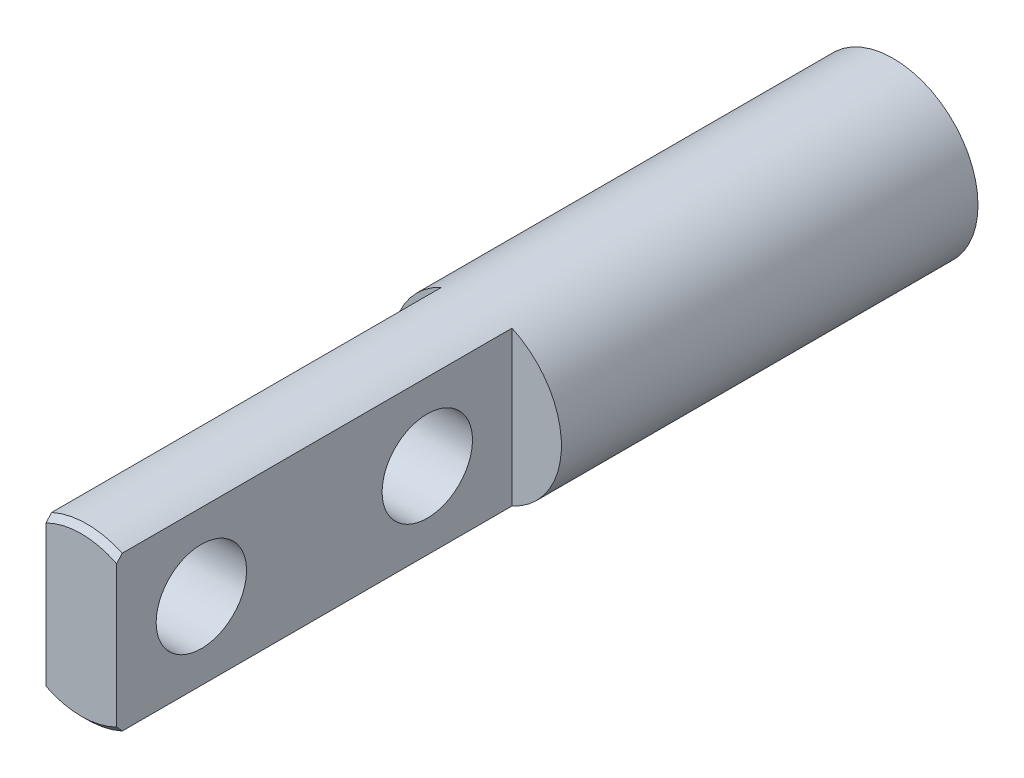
SolidWorks part; units mm, degrees
ref_plane "Front Plane" through (0, 0, 0) normal (0, 0, 1) x (1, 0, 0)
ref_plane "Top Plane" through (0, 0, 0) normal (0, 1, 0) x (1, 0, 0)
ref_plane "Right Plane" through (0, 0, 0) normal (1, 0, 0) x (0, 0, -1)
sketch "Sketch1" plane through (0, 0, 0) normal (0, 0, 1) x (1, 0, 0)
  circle A0 centre (0, 0) radius 3
  dimension "D1" = 6
extrude "Boss-Extrude1" add sketch "Sketch1" along normal blind 14.75
sketch "Sketch2" plane through (0, 0, 14.75) normal (0, 0, 1) x (1, 0, 0)
  line L0 (0, 0) -> (0, 3.1265) construction
  line L1 (1.25, -2.7272) -> (1.25, 2.7272)
  line L2 (-1.25, -2.7272) -> (-1.25, 2.7272)
  line L3 (-1.25, 0) -> (-1.25, 3.1265) construction
  line L4 (1.25, 0) -> (1.25, 3.1265) construction
  arc A0 (-1.25, -2.7272) -> (1.25, -2.7272) centre (0, 0) ccw
  arc A1 (1.25, 2.7272) -> (-1.25, 2.7272) centre (0, 0) ccw
  dimension "D1" = 6
  dimension "D2" = 1.25
  dimension "D3" = 1.25
extrude "Boss-Extrude2" add sketch "Sketch2" along normal blind 14
sketch "Sketch3" plane through (-1.25, 0, 0) normal (-1, 0, 0) x (0, 0, 1)
  line L0 (28.75, 2.7272) -> (28.75, -2.7272) construction
  circle A0 centre (25.75, 0) radius 1.6
  circle A1 centre (17.75, 0) radius 1.6
  dimension "D3" = 3.2
  dimension "D1" = 3
  dimension "D2" = 8
extrude "Cut-Extrude1" cut sketch "Sketch3" against normal up to surface (2.5 mm away)
chamfer "Chamfer1" distance 0.2 angle 45 2 edges at (0, -3, 28.75) (0, 3, 28.75)
